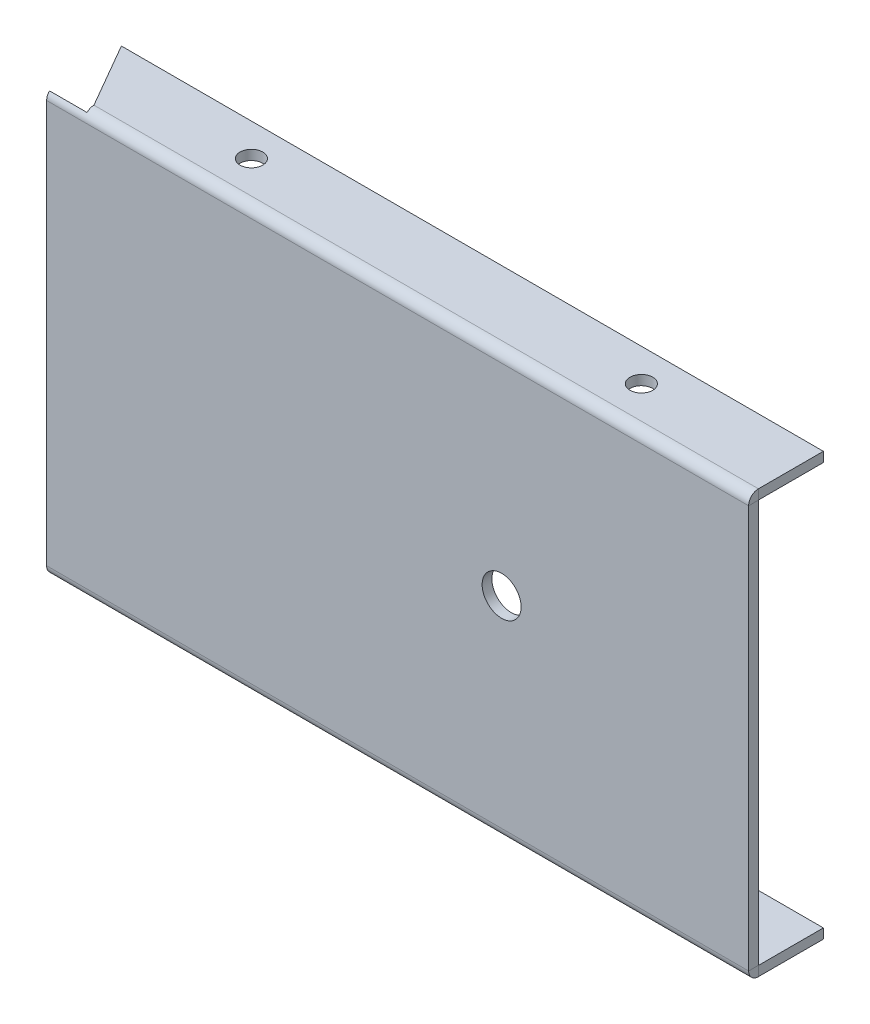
SolidWorks part; units mm, degrees
ref_plane "Front Plane" through (0, 0, 0) normal (0, 0, 1) x (1, 0, 0)
ref_plane "Top Plane" through (0, 0, 0) normal (0, 1, 0) x (1, 0, 0)
ref_plane "Right Plane" through (0, 0, 0) normal (1, 0, 0) x (0, 0, -1)
sketch "Sketch1" plane through (0, 0, 0) normal (0, 0, 1) x (1, 0, 0)
  line L0 (0, 0) -> (5.7735, 10)
  line L1 (5.7735, 10) -> (0, 10)
  line L2 (0, 10) -> (0, 72)
  line L3 (0, 72) -> (5.7735, 72)
  line L4 (5.7735, 72) -> (0, 82)
  line L5 (0, 82) -> (108, 82)
  line L6 (108, 82) -> (108, 0)
  line L7 (108, 0) -> (0, 0)
  line L8 (0, 41) -> (108, 41) construction
  line L9 (25, 77) -> (85, 77) construction
  line L10 (85, 5) -> (25, 5) construction
  line L11 (85, 77) -> (85, 5) construction
  line L12 (25, 77) -> (25, 5) construction
  circle A0 centre (70, 41) radius 3
  circle A1 centre (85, 77) radius 1.75
  circle A2 centre (25, 77) radius 1.75
  circle A3 centre (25, 5) radius 1.75
  circle A4 centre (85, 5) radius 1.75
  dimension "D1" = 3.5
  dimension "D2" = 6
  dimension "D12" = 15
  dimension "D13" = 45
  dimension "D14" = 25
  dimension "D3" = 5
  dimension "D4" = 5
  dimension "D5" = 30
  dimension "D6" = 30
  dimension "D7" = 10
  dimension "D8" = 10
  dimension "D11" = 23
  dimension "D15" = 82
sheet metal parameters "Sheet-Metal1" thickness 1.5 parameters "D1"=1
base flange "Base-Flange1" sketch "Sketch1" thickness 1.5 reverse thickness direction yes parameters "D1"=1
sketch "Sketch3" plane through (0, 0, 1.5) normal (0, 0, 1) x (1, 0, 0)
  line L0 (5.7735, 72) -> (108, 72)
  line L1 (108, 0) -> (108, 82) construction
  line L2 (5.7735, 10) -> (108, 10)
sketched bend "Sketched Bend1" parameters "D1"=0.01
bend "SketchBend1" bend radius 0.01 bend angle 90 parameters "D5"=1
bend "SketchBend2" bend radius 0 bend angle 90 parameters "D5"=2
flat pattern "Flat-Pattern1"
sketch "Bend-Lines1" plane through (0, 0, 0) normal (0, 1, 0) x (-1, 0, 0)
bend of the flat pattern "Flatten-<SketchBend1>1"
bend of the flat pattern "Flatten-<SketchBend2>1"
